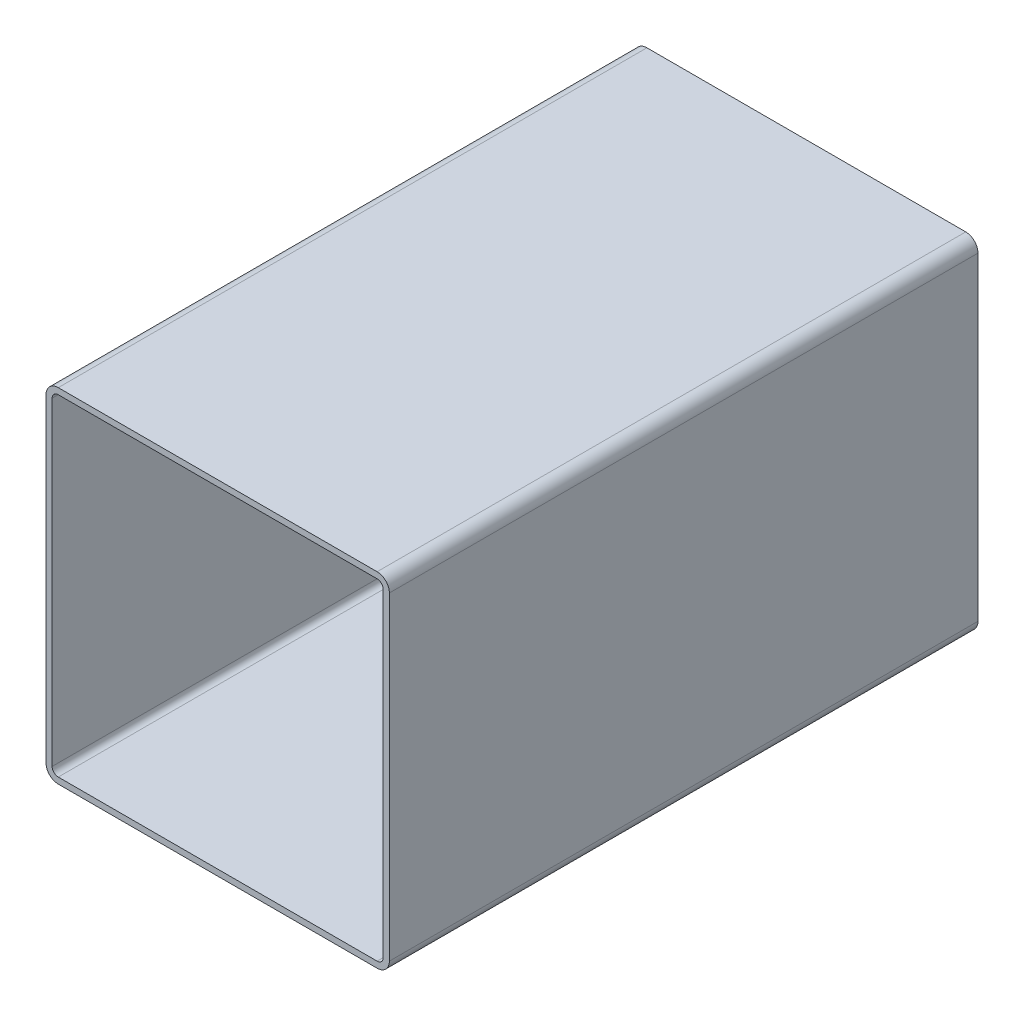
SolidWorks part; units mm, degrees
ref_plane "Front Plane" through (0, 0, 0) normal (0, 0, 1) x (1, 0, 0)
ref_plane "Top Plane" through (0, 0, 0) normal (0, 1, 0) x (1, 0, 0)
ref_plane "Right Plane" through (0, 0, 0) normal (1, 0, 0) x (0, 0, -1)
sketch "Sketch1" plane through (0, 0, 0) normal (0, 0, 1) x (1, 0, 0)
sketch_block_instance "HSS7x7x0.125-1"
sketch_block "HSS7x7x0.125"
extrude "Boss-Extrude1" add sketch "Sketch1" along normal blind 304.8
